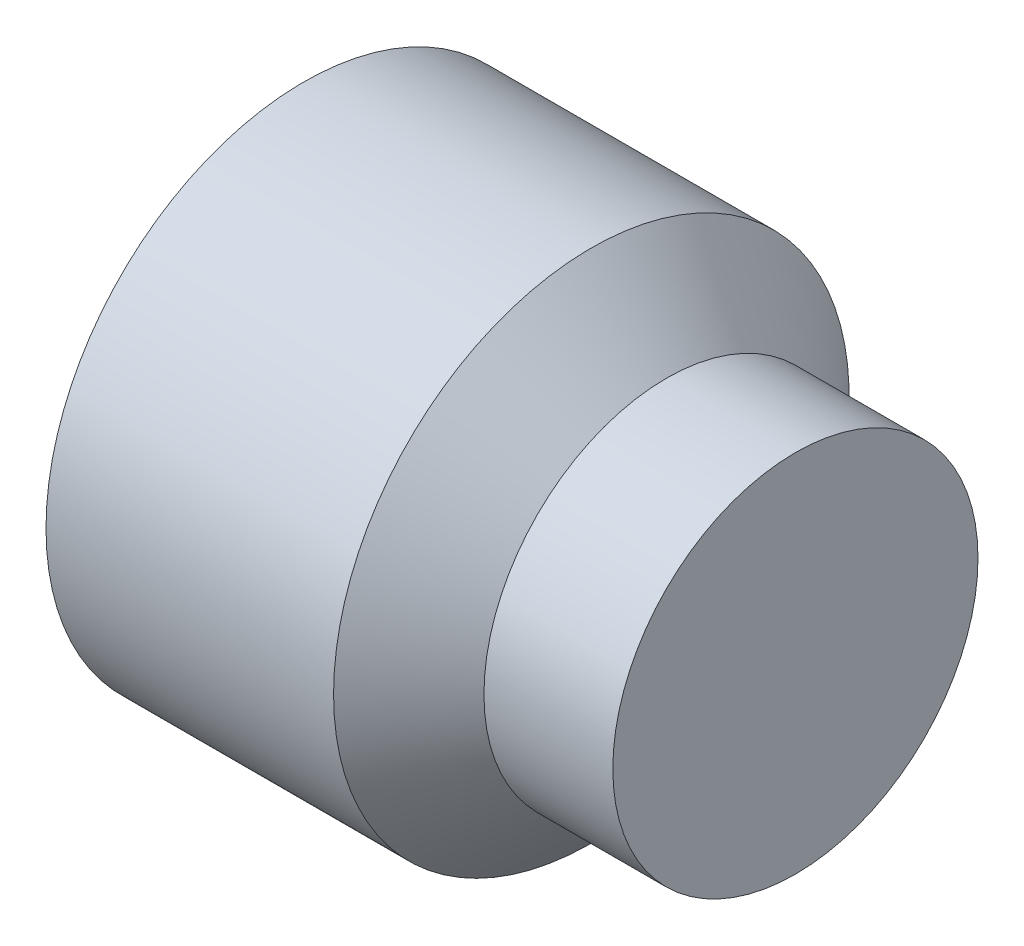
SolidWorks part; units mm, degrees
ref_plane "Front Plane" through (0, 0, 0) normal (0, 0, 1) x (1, 0, 0)
ref_plane "Top Plane" through (0, 0, 0) normal (0, 1, 0) x (1, 0, 0)
ref_plane "Right Plane" through (0, 0, 0) normal (1, 0, 0) x (0, 0, -1)
sketch "BodySke" plane through (0, 0, 0) normal (0, 0, 1) x (1, 0, 0)
  line L0 (0, 0) -> (88.3411, 0) construction
  line L1 (0, 0) -> (0, 5.036)
  line L2 (0, 5.036) -> (0.5566, 6)
  line L3 (0.5566, 6) -> (7.25, 6)
  line L4 (9, 4.25) -> (7.25, 6)
  line L6 (12, 0) -> (0, 0)
  line L7 (1.75, 0) -> (1.75, 8.5388) construction
  line L8 (0, -5.036) -> (0.5566, -6) construction
  line L9 (9, 4.25) -> (12, 4.25)
  line L10 (12, 4.25) -> (12, 0)
  dimension "Diameter" = 12
  dimension "Thread_minor" = 10.072
  dimension "Length" = 12
  dimension "Dog_dia" = 8.5
  dimension "Nose_chamfer_angle" = 45
  dimension "Drive_chamfer_angle" = 120
  dimension "Advance" = 1.75
  dimension "Dog_length" = 3
revolve "BaseBody" add sketch "BodySke" angle 360 about L0
sketch "CountersinkSke" plane through (0, 0, 0) normal (1, 0, 0) x (0, 0, -1)
  line L1 (0, 3.4641) -> (-3, 1.7321)
  line L2 (-3, 1.7321) -> (-3, -1.7321)
  line L3 (-3, -1.7321) -> (0, -3.4641)
  line L4 (0, -3.4641) -> (3, -1.7321)
  line L5 (3, -1.7321) -> (3, 1.7321)
  line L6 (3, 1.7321) -> (0, 3.4641)
  circle A0 centre (0, 0) radius 3 construction
  dimension "Countersink_width" = 6
extrude "Countersink" cut sketch "CountersinkSke" along normal blind 4.8
sketch "ThdSchSke" plane through (0, 0, 0) normal (0, 0, 1) x (1, 0, 0)
  line L0 (0, 0) -> (53.6961, 0) construction
  line L1 (1.1934, 7.1131) -> (1.1934, 6)
  line L2 (1.1934, 7.1131) -> (2.3066, 7.1131)
  line L3 (2.3066, 7.1131) -> (2.3066, 6)
  line L4 (2.3066, 6) -> (1.75, 5.036)
  line L5 (1.75, 5.036) -> (1.1934, 6)
  dimension "D1" = 1.75
revolve "ThreadSchematic" [suppressed] cut sketch "ThdSchSke" angle 360 about L0
pattern_linear "ThdSchPat" [suppressed]
equation "\"Thread_minor@ThreadCosmetic\" = \"Thread_minor@BodySke\""
equation "\"D1@ThdSchSke\" = \"Advance@BodySke\""
equation "\"Advance@ThdSchPat\" = \"Advance@BodySke\""
equation "\"Tooth_Num@ThdSchPat\" =  int( (  \"Length@BodySke\" - \"Dog_length@BodySke\" )  / \"Advance@BodySke\" )  - 1"
